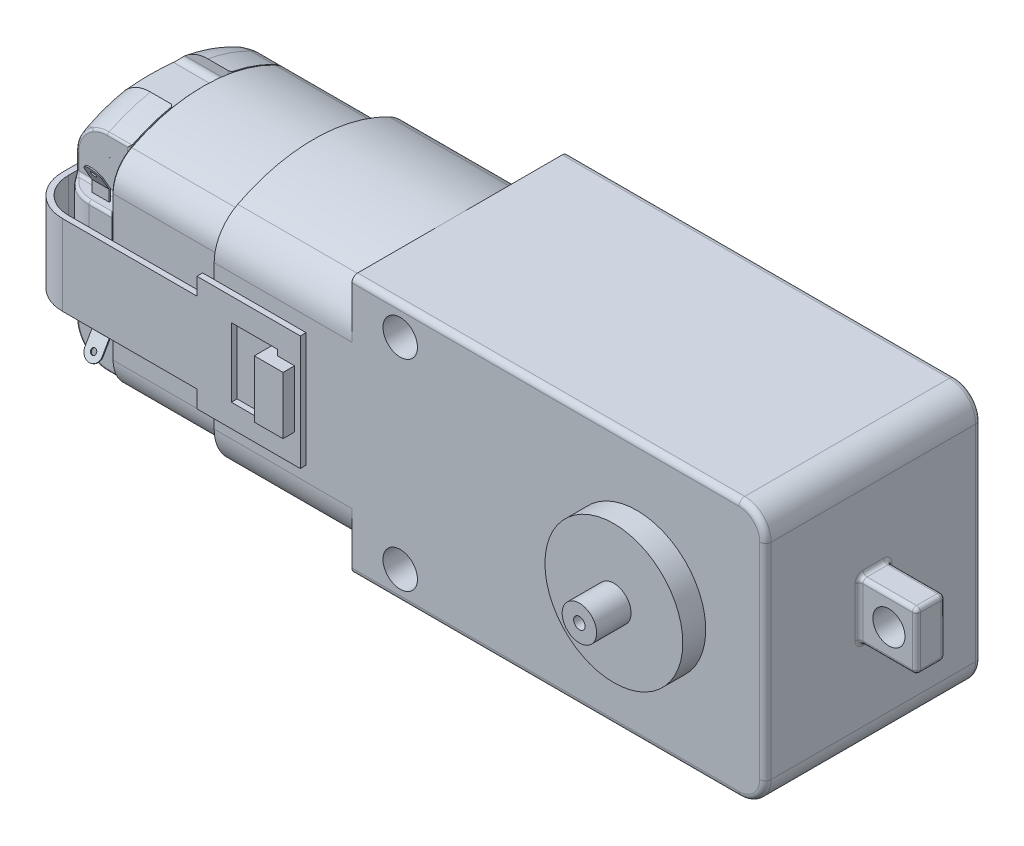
SolidWorks part; units mm, degrees
ref_plane "Alzado" through (0, 0, 0) normal (0, 0, 1) x (1, 0, 0)
ref_plane "Planta" through (0, 0, 0) normal (0, 1, 0) x (1, 0, 0)
ref_plane "Vista lateral" through (0, 0, 0) normal (1, 0, 0) x (0, 0, -1)
sketch "Croquis1" plane through (0, 0, 0) normal (0, 0, 1) x (1, 0, 0)
  line L1 (45.7, 11.25) -> (0, 11.25)
  line L2 (48, 8.95) -> (48, -8.95)
  line L3 (45.7, -11.25) -> (0, -11.25)
  line L4 (0, 11.25) -> (0, -11.25)
  arc A0 (48, -8.95) -> (45.7, -11.25) centre (45.7, -8.95) cw
  arc A1 (45.7, 11.25) -> (48, 8.95) centre (45.7, 8.95) cw
  point P7 (48, -11.25)
  point P10 (48, 11.25)
  dimension "D3" = 2.3
  dimension "D1" = 22.5
  dimension "D2" = 48
extrude "Saliente-Extruir1" add sketch "Croquis1" along normal mid plane 18.8
fillet "Redondeo1" radius 0.5 10 edges at (22.85, -11.25, -9.4) (47.3263, -10.5763, -9.4) (48, 0, -9.4) (47.3263, 10.5763, -9.4) (22.85, -11.25, 9.4) (47.3263, -10.5763, 9.4) (48, 0, 9.4) (47.3263, 10.5763, 9.4) (22.85, 11.25, -9.4) (22.85, 11.25, 9.4)
sketch "Axe roue" plane through (0, 0, 9.4) normal (0, 0, 1) x (1, 0, 0)
  line L0 (48, 8.95) -> (48, -8.95) construction
  line L1 (36.8, 0) -> (47.5, 0) construction
  line L2 (47.5, -8.95) -> (47.5, 8.95) construction
  circle A0 centre (36.8, 0) radius 1.5
  dimension "D1" = 11.2
  dimension "D2" = 3
sketch "Croquis4" plane through (0, 11.25, 0) normal (0, 1, 0) x (1, 0, 0)
  line L0 (48, -8.9) -> (48, 8.9) construction
  line L1 (0, 9.4) -> (12, 9.4)
  line L2 (0, 9.4) -> (0, 7.9)
  line L3 (0, 7.9) -> (12, 7.9)
  line L4 (12, 9.4) -> (12, 7.9)
  dimension "D1" = 36
  dimension "D2" = 1.5
extrude "Cortar-Extruir2" cut sketch "Croquis4" against normal through all
fillet "Redondeo3" radius 0.5 2 edges at (6, -11.25, -7.9) (6, 11.25, -7.9)
sketch "Croquis5" plane through (0, 0, -9.4) normal (0, 0, -1) x (-1, 0, 0)
  line L0 (-16.2, 8.75) -> (-16.2, -8.75) construction
  line L1 (-16.2, 0) -> (0, 0) construction
  line L2 (-48, -8.95) -> (-48, 8.95) construction
  circle A0 centre (-16.2, 8.75) radius 1.5
  circle A1 centre (-16.2, -8.75) radius 1.5
  dimension "D1" = 3
  dimension "D2" = 17.5
  dimension "D3" = 31.8
extrude "Cortar-Extruir3" cut sketch "Croquis5" against normal up to surface (18.8 mm away) contours A1 | A0
sketch "Croquis7" plane through (0, 0, 0) normal (0, 1, 0) x (1, 0, 0)
  line L0 (8, 7.9) -> (-12.7, 7.9)
  line L1 (0, 7.9) -> (12, 7.9) construction
  line L2 (-15.7, 4.9) -> (-15.7, -6.4)
  line L3 (-12.7, -9.4) -> (8, -9.4)
  line L4 (45.7, -9.4) -> (0, -9.4) construction
  line L5 (8, 8.4) -> (-12.7, 8.4)
  line L6 (-16.2, 4.9) -> (-16.2, -6.4)
  line L7 (-12.7, -9.9) -> (8, -9.9)
  line L8 (8, 8.4) -> (8, 7.9)
  line L9 (8, -9.9) -> (8, -9.4)
  line L10 (48, -8.9) -> (48, 8.9) construction
  arc A0 (-12.7, 7.9) -> (-15.7, 4.9) centre (-12.7, 4.9) ccw
  arc A1 (-15.7, -6.4) -> (-12.7, -9.4) centre (-12.7, -6.4) ccw
  arc A2 (-12.7, 8.4) -> (-16.2, 4.9) centre (-12.7, 4.9) ccw
  arc A3 (-16.2, -6.4) -> (-12.7, -9.9) centre (-12.7, -6.4) ccw
  dimension "D4" = 3
  dimension "D2" = 4
  dimension "D3" = 64.2
  dimension "D1" = 0.5
extrude "Saliente-Extruir3" add sketch "Croquis7" along normal mid plane 10 separate body
sketch "Croquis8" plane through (0, 0, -8.4) normal (0, 0, -1) x (-1, 0, 0)
  line L0 (-8, 5) -> (12.7, 5) construction
  line L1 (1, 5) -> (16.2, 5)
  line L2 (1, 5) -> (1, 3.5)
  line L3 (1, 3.5) -> (16.2, 3.5)
  line L4 (16.2, 5) -> (16.2, 3.5)
  line L5 (16.2, 5) -> (16.2, -5) construction
  line L6 (-8, -5) -> (12.7, -5) construction
  line L7 (1, -5) -> (16.2, -5)
  line L8 (1, -5) -> (1, -3.5)
  line L9 (1, -3.5) -> (16.2, -3.5)
  line L10 (16.2, -5) -> (16.2, -3.5)
  line L11 (0, -10.75) -> (0, 10.75) construction
  line L12 (-6, 3) -> (-2, 3)
  line L13 (-8, 5) -> (0, 5) construction
  line L14 (-8, 5) -> (-8, -5) construction
  line L15 (-8, -5) -> (0, -5) construction
  line L16 (0, 5) -> (0, -5) construction
  line L17 (-2, 3) -> (-2, -3)
  line L18 (-6, -3) -> (-2, -3)
  line L19 (-6, 3) -> (-6, -3)
  dimension "D1" = 7
  dimension "D2" = 1
  dimension "D3" = 2
extrude "Cortar-Extruir4" cut sketch "Croquis8" against normal through all
sketch "Croquis9" plane through (0, 0, 0) normal (0, 1, 0) x (1, 0, 0)
  line L0 (6, 7.9) -> (6, 8.4)
  line L1 (0, 7.9) -> (12, 7.9) construction
  line L2 (6, 8.4) -> (7.5, 8.4)
  line L3 (8, 8.4) -> (-1, 8.4) construction
  line L4 (7.5, 8.4) -> (7.5, 9.4)
  line L5 (7.5, 9.4) -> (5, 9.4)
  line L6 (5, 9.4) -> (5, 7.9)
  line L7 (-1, 7.9) -> (8, 7.9) construction
  line L8 (5, 7.9) -> (6, 7.9)
  line L9 (0, -0.75) -> (12, -0.75) construction
  line L10 (12, 7.4) -> (0, 7.4) construction
  line L11 (0, -8.9) -> (0, 7.4) construction
  line L12 (5, -9.4) -> (6, -9.4)
  line L13 (5, -10.9) -> (5, -9.4)
  line L14 (7.5, -10.9) -> (5, -10.9)
  line L15 (7.5, -9.9) -> (7.5, -10.9)
  line L16 (6, -9.9) -> (7.5, -9.9)
  line L17 (6, -9.4) -> (6, -9.9)
  dimension "D1" = 1
  dimension "D2" = 1.5
extrude "Saliente-Extruir4" add sketch "Croquis9" along normal mid plane 5
sketch "Croquis10" plane through (0, 0, 0) normal (-1, 0, 0) x (0, 0, 1)
  line L0 (-7.1, 7.95) -> (-7.1, -7.95)
  line L1 (8.6, 7.95) -> (8.6, -7.95)
  line L2 (0.75, 10.45) -> (0.75, 11.25) construction
  line L3 (8.9, 11.25) -> (-7.4, 11.25) construction
  line L4 (0.75, -10.45) -> (0.75, -11.25) construction
  line L5 (8.9, -11.25) -> (-7.4, -11.25) construction
  line L6 (-7.9, -10.75) -> (-7.9, 10.75) construction
  arc A0 (-7.1, 7.95) -> (8.6, 7.95) centre (0.75, -3.1245) cw
  arc A1 (-7.1, -7.95) -> (8.6, -7.95) centre (0.75, 3.1245) ccw
  dimension "D1" = 0.8
  dimension "D2" = 0.8
  dimension "D3" = 2.5
extrude "Saliente-Extruir5" add sketch "Croquis10" along normal offset from surface (14.7 mm away) 1 separate body
sketch "Croquis11" plane through (0, 0, 0) normal (-1, 0, 0) x (0, 0, 1)
  line L0 (-7.9, -10.75) -> (-7.9, 10.75) construction
  line L1 (9.4, 10.75) -> (9.4, -10.75) construction
  line L2 (8.9, 11.25) -> (-7.4, 11.25) construction
  line L3 (-7.9, 8.3561) -> (-7.9, 11.25)
  line L4 (-7.9, 11.25) -> (9.4, 11.25)
  line L5 (9.4, 11.25) -> (9.4, 8.3561)
  line L6 (-7.4, 11.25) -> (-8.9, 11.25) construction
  line L7 (8.9, -11.25) -> (-7.4, -11.25) construction
  line L8 (-7.9, -8.3561) -> (-7.9, -11.25)
  line L9 (-7.4, -11.25) -> (-8.9, -11.25) construction
  line L10 (-7.9, -11.25) -> (9.4, -11.25)
  line L11 (9.4, -11.25) -> (9.4, -8.3561)
  arc A0 (-7.9, 8.3561) -> (9.4, 8.3561) centre (0.75, -3.1245) cw
  arc A1 (8.6, 7.95) -> (-7.1, 7.95) centre (0.75, -3.1245) ccw construction
  arc A2 (-7.9, -8.3561) -> (9.4, -8.3561) centre (0.75, 3.1245) ccw
  arc A3 (-7.1, -7.95) -> (8.6, -7.95) centre (0.75, 3.1245) ccw construction
extrude "Cortar-Extruir6" cut sketch "Croquis11" against normal up to surface (12 mm away) contours A0 L4 M1 M8 | A0 M7 M5 M6 | A2 M1 M2 M3 | A2 L10 M4 M5
fillet "Redondeo5" radius 3 4 edges at (-7.35, 7.95, -7.1) (-7.35, -7.95, -7.1) (-7.35, -7.95, 8.6) (-7.35, 7.95, 8.6)
fillet "Redondeo6" radius 3.8 4 edges at (6, 8.3561, 9.4) (6, -8.3561, -7.9) (6, 8.3561, -7.9) (6, -8.3561, 9.4)
shell "Vaciado1" thickness 0.8
fillet "Redondeo7" radius 3 8 edges at (-14.7, 7.833, 8.162) (-14.7, 0, 8.6) (-14.7, -7.833, 8.162) (-14.7, -10.45, 0.75) (-14.7, -7.833, -6.662) (-14.7, 0, -7.1) (-14.7, 7.833, -6.662) (-14.7, 10.45, 0.75)
sketch "Croquis12" plane through (-14.7, 0, 0) normal (-1, 0, 0) x (0, 0, 1)
  line L0 (0.75, 7.45) -> (0.75, -7.45) construction
  circle A0 centre (0.75, 0) radius 3.75
  arc A1 (5.6, 6.2722) -> (-4.1, 6.2722) centre (0.75, -3.1245) ccw construction
  arc A2 (-4.1, -6.2722) -> (5.6, -6.2722) centre (0.75, 3.1245) ccw construction
  dimension "D1" = 7.5
extrude "Saliente-Extruir6" add sketch "Croquis12" along normal up to surface (1 mm away)
sketch "Croquis13" plane through (-15.7, 0, 0) normal (-1, 0, 0) x (0, 0, 1)
  circle A0 centre (0.75, 0) radius 0.95
  dimension "D1" = 1.9
extrude "Saliente-Extruir7" add sketch "Croquis13" along normal blind 1 separate body
sketch "Croquis14" plane through (-16.2, 0, 0) normal (-1, 0, 0) x (0, 0, 1)
  circle A0 centre (0.75, 0) radius 4.25
  circle A1 centre (0.75, 0) radius 3.75 construction
  dimension "D1" = 0.5
extrude "Saliente-Extruir8" add sketch "Croquis14" against normal up to surface (0.5 mm away)
sketch "Croquis15" plane through (-16.2, 0, 0) normal (-1, 0, 0) x (0, 0, 1)
  circle A0 centre (0.75, 0) radius 1
  circle A1 centre (0.75, 0) radius 0.95 construction
  dimension "D1" = 0.05
extrude "Cortar-Extruir7" cut sketch "Croquis15" against normal up to surface (0.5 mm away)
fillet "Redondeo8" radius 0.35 1 edges at (-16.7, 0, 1.7)
sketch "Croquis16" plane through (0, 0, 0) normal (0, 1, 0) x (1, 0, 0)
  line L0 (-9.7, 7.1) -> (-9.7, -8.6)
  line L1 (-11.7, 7.1) -> (0, 7.1) construction
  line L2 (0, -8.6) -> (-11.7, -8.6) construction
  dimension "D1" = 6
split "Partir4" trim tools "Croquis16" bodies to split 112 resulting bodies 118 119
sketch "Croquis17" plane through (0, 0, 0) normal (0, 0, 1) x (1, 0, 0)
  line L0 (48, 8.95) -> (48, -8.95) construction
  line L1 (48, 2.5) -> (53, 2.5)
  line L2 (48, 2.5) -> (48, -2.5)
  line L3 (48, -2.5) -> (53, -2.5)
  line L4 (53, 2.5) -> (53, -2.5)
  line L5 (48, 0) -> (53, 0) construction
  circle A0 centre (50.6, 0) radius 1.4
  dimension "D3" = 2.4
  dimension "D4" = 2.8
  dimension "D1" = 5
  dimension "D2" = 5
extrude "Saliente-Extruir9" add sketch "Croquis17" along normal mid plane 2.5
fillet "Redondeo12" radius 0.35 2 edges at (53, -2.5, 0) (53, 2.5, 0)
fillet "Redondeo13" radius 0.35 10 edges at (50.325, -2.5, -1.25) (52.8975, -2.3975, -1.25) (53, 0, -1.25) (52.8975, 2.3975, -1.25) (50.325, -2.5, 1.25) (52.8975, -2.3975, 1.25) (53, 0, 1.25) (52.8975, 2.3975, 1.25) (50.325, 2.5, -1.25) (50.325, 2.5, 1.25)
fillet "Redondeo14" radius 0.35 8 edges at (48, 2.3975, 1.1475) (48, 2.5, 0) (48, 2.3975, -1.1475) (48, 0, -1.25) (48, -2.3975, -1.1475) (48, -2.5, 0) (48, -2.3975, 1.1475) (48, 0, 1.25)
sketch "Croquis18" plane through (-14.7, 0, 0) normal (-1, 0, 0) x (0, 0, 1)
  line L0 (-1.75, 10.2178) -> (-1.75, 9.45)
  line L1 (-1.25, 8.95) -> (2.75, 8.95)
  line L2 (3.25, 9.45) -> (3.25, 10.2178)
  line L3 (0.75, 8.95) -> (0.75, 0) construction
  line L4 (0.75, 10.45) -> (0.75, 8.95) construction
  line L5 (0.75, 0) -> (6.4, 0) construction
  line L6 (6.4, 3.5) -> (6.4, -3.5) construction
  line L7 (-1.25, -8.95) -> (2.75, -8.95)
  line L8 (3.25, -9.45) -> (3.25, -10.2178)
  line L9 (-1.75, -10.2178) -> (-1.75, -9.45)
  line L10 (8.6, 6.2722) -> (6.976, 6.2722) construction
  line L12 (6.976, 6.2722) -> (6.976, 8.938)
  line L13 (6.976, -8.938) -> (6.976, -6.2722)
  line L14 (5.6, -6.2722) -> (8.6, -6.2722) construction
  line L15 (6.976, -6.2722) -> (8.6, -6.2722) construction
  line L16 (6.976, 6.2722) -> (6.976, 4.6481)
  line L17 (6.976, 4.6481) -> (8.6, 4.6481)
  line L18 (8.6, 6.2722) -> (8.6, -6.2722) construction
  line L19 (8.6, 4.6481) -> (8.6, 6.2722)
  line L20 (6.976, -6.2722) -> (6.976, -4.6481)
  line L21 (6.976, -4.6481) -> (8.6, -4.6481)
  line L22 (8.6, -4.6481) -> (8.6, -6.2722)
  arc A0 (-1.75, 10.2178) -> (3.25, 10.2178) centre (0.75, -3.1245) cw
  arc A1 (-1.75, 9.45) -> (-1.25, 8.95) centre (-1.25, 9.45) ccw
  arc A2 (2.75, 8.95) -> (3.25, 9.45) centre (2.75, 9.45) ccw
  arc A3 (5.6, 6.2722) -> (-4.1, 6.2722) centre (0.75, -3.1245) ccw
  arc A4 (5.6, 6.2722) -> (-4.1, 6.2722) centre (0.75, -3.1245) ccw
  arc A6 (6.976, 8.938) -> (-5.476, 8.938) centre (0.75, -3.1245) ccw construction
  arc A7 (-1.75, -9.45) -> (-1.25, -8.95) centre (-1.25, -9.45) cw
  arc A8 (2.75, -8.95) -> (3.25, -9.45) centre (2.75, -9.45) cw
  arc A9 (-1.75, -10.2178) -> (3.25, -10.2178) centre (0.75, 3.1245) ccw
  arc A10 (8.6, 6.2722) -> (6.976, 8.938) centre (5.6, 6.2722) ccw
  arc A11 (8.6, 6.2722) -> (6.976, 8.938) centre (5.6, 6.2722) ccw construction
  arc A12 (6.976, -8.938) -> (8.6, -6.2722) centre (5.6, -6.2722) ccw construction
  arc A13 (8.6, -6.2722) -> (6.976, -8.938) centre (5.6, -6.2722) cw
  dimension "D3" = 0.5
  dimension "D1" = 1.5
  dimension "D2" = 5
extrude "Cortar-Extruir8" cut sketch "Croquis18" against normal up to vertex contours L1 A2 L2 A0 L0 A1 | L10 A10 L12 | A13 L15 L13 | L9 A9 L8 A8 L7 A7
fillet "Redondeo17" radius 0.25 26 edges at (-10.7, -4.6481, 8.6) (-10.7, 4.6481, 8.6) (-13.2608, -4.6481, 8.162) (-9.7, -4.6481, 7.788) (-9.7, 4.6481, 7.788) (-13.2608, 4.6481, 8.162) (-9.7, -9.8339, -1.75) (-9.7, -9.0964, -1.6036) (-9.7, -9.8339, 3.25) (-9.7, -9.0964, 3.1036) (-9.7, 9.8339, -1.75) (-9.7, 9.8339, 3.25) (-9.7, 9.0964, 3.1036) (-9.7, 8.95, 0.75) (-10.7, 8.938, 6.976) (-13.585, 8.1572, 6.976) (-10.7, -8.938, 6.976) (-14.3659, -5.4602, 6.976) (-9.7, -8.95, 0.75) (-9.7, -6.7931, 6.976) (-9.7, 9.0964, -1.6036) (-9.7, 6.7931, 6.976) (-14.3659, 5.4602, 6.976) (-13.585, -8.1572, 6.976) (-12.0329, -4.6481, 6.976) (-12.0329, 4.6481, 6.976)
chamfer "Chaflán1" distance 0.1 angle 45 8 edges at (-9.7, 0, -7.1) (-9.7, 7.833, -6.662) (-9.7, 10.45, 0.75) (-9.7, 7.833, 8.162) (-9.7, 0, 8.6) (-9.7, -7.833, 8.162) (-9.7, -10.45, 0.75) (-9.7, -7.833, -6.662)
ref_plane "Plano1" through (-11.5, 0, 0) normal (1, 0, 0) x (0, 0, -1)
sketch "Croquis19" plane through (-11.5, 0, 0) normal (1, 0, 0) x (0, 0, -1)
  line L0 (-7.788, 4.6481) -> (-7.788, 5.6213)
  line L1 (-7.788, 5.6213) -> (-8.7746, 7.3302)
  line L2 (-8.6, 4.3981) -> (-7.3738, 4.3981)
  line L3 (-7.226, 4.6481) -> (-8.35, 4.6481)
  line L4 (-8.6, 4.3981) -> (-7.3738, 4.3981) construction
  line L5 (-7.226, 4.6481) -> (-8.35, 4.6481) construction
  line L6 (-8.35, -4.6481) -> (-7.226, -4.6481)
  line L7 (-7.3738, -4.3981) -> (-8.6, -4.3981)
  line L8 (-8.35, -4.6481) -> (-7.226, -4.6481) construction
  line L9 (-7.3738, -4.3981) -> (-8.6, -4.3981) construction
  line L10 (-7.688, 4.6481) -> (-7.688, 5.6481)
  line L11 (-7.688, 5.6481) -> (-8.688, 7.3802)
  line L12 (-8.688, 7.3802) -> (-8.7746, 7.3302)
  line L13 (-7.688, 4.6481) -> (-7.788, 4.6481)
  arc A1 (-8.35, 4.6481) -> (-8.6, 4.3981) centre (-8.35, 4.3981) ccw
  arc A2 (-8.35, 4.6481) -> (-8.6, 4.3981) centre (-8.35, 4.3981) ccw construction
  arc A3 (-8.6, -4.3981) -> (-8.35, -4.6481) centre (-8.35, -4.3981) ccw
  arc A4 (-8.6, -4.3981) -> (-8.35, -4.6481) centre (-8.35, -4.3981) ccw construction
  ellipse E1 centre (-7.226, 4.3981) end of major axis (-7.226, 4.6481) minor radius 0.1478 (-7.226, 4.6481) -> (-7.3738, 4.3981) ccw
  ellipse E2 centre (-7.226, 4.3981) end of major axis (-7.226, 4.6481) minor radius 0.1478 (-7.226, 4.6481) -> (-7.3738, 4.3981) ccw construction
  ellipse E3 centre (-7.226, -4.3981) end of major axis (-7.226, -4.1481) minor radius 0.1478 (-7.3738, -4.3981) -> (-7.226, -4.6481) ccw
  ellipse E4 centre (-7.226, -4.3981) end of major axis (-7.226, -4.1481) minor radius 0.1478 (-7.3738, -4.3981) -> (-7.226, -4.6481) ccw construction
  dimension "D4" = 1
  dimension "D5" = 2
  dimension "D6" = 150
  dimension "D1" = 0
  dimension "D2" = 0
  dimension "D3" = 0.1
extrude "Saliente-Extruir10" add sketch "Croquis19" along normal mid plane 1.5 separate body contours L10 L11 L12 L1 L0 L13
fillet "Redondeo18" radius 0.75 2 edges at (-10.75, 7.3552, 8.7313) (-12.25, 7.3552, 8.7313)
sketch "Croquis21" plane through (0, -1.967, 3.4069) normal (0, -0.5, 0.866) x (1, 0, 0)
  circle A0 centre (-11.5, 9.9854) radius 0.25
  dimension "D1" = 0.5
extrude "Cortar-Extruir9" cut sketch "Croquis21" against normal blind 1.5
mirror "Simetría2" about plane through (0, 0, 0) normal (0, 1, 0)
extrude "Boss. Axe roue" add sketch "Axe roue" along normal blind 5
sketch "Esquisse1" plane through (0, 0, 14.4) normal (0, 0, 1) x (1, 0, 0)
  circle A0 centre (36.8, 0) radius 0.5
extrude "Enlèv. mat.-Extru.1" cut sketch "Esquisse1" against normal blind 2
sketch "Esquisse2" plane through (0, 0, 9.4) normal (0, 0, 1) x (1, 0, 0)
  circle A0 centre (36.8, 0) radius 6
extrude "Boss.-Extru.2" add sketch "Esquisse2" along normal blind 2
